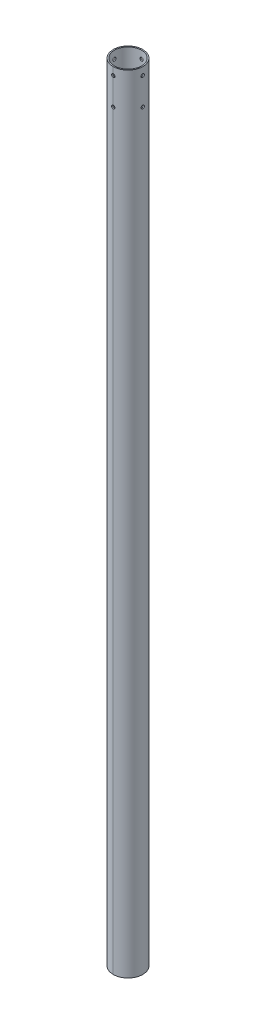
SolidWorks part; units mm, degrees
ref_plane "Plan de face" through (0, 0, 0) normal (0, 0, 1) x (1, 0, 0)
ref_plane "Plan de dessus" through (0, 0, 0) normal (0, 1, 0) x (1, 0, 0)
ref_plane "Plan de droite" through (0, 0, 0) normal (1, 0, 0) x (0, 0, -1)
sketch "Esquisse1" plane through (0, 0, 0) normal (0, 0, 1) x (1, 0, 0)
  line L0 (35, 980) -> (38, 980)
  line L4 (38, 980) -> (38, 3000)
  line L10 (0, 3115.5399) -> (0, -377.5747) construction
  line L11 (35, 980) -> (35, 3000)
  line L12 (38, 3000) -> (35, 3000)
  dimension "D2" = 2020
  dimension "D1" = 3000
  dimension "D4" = 76
  dimension "D9" = 3
revolve "tube" add sketch "Esquisse1" angle 360 about L10
hole_wizard "Trou taraudé M101" positions "Esquisse4" profile "Esquisse3" tap size "M10" standard "Iso"
sketch "Esquisse4" plane through (0, 0, 0) normal (0, 0, 1) x (1, 0, 0)
  line L0 (0, 980) -> (0, 3000) construction
  line L1 (38, 3000) -> (-38, 3000) construction
  point P0 (0, 2980)
  point P4 (0, 2910)
  dimension "D1" = 20
  dimension "D2" = 70
sketch "Esquisse3" plane through (0, 2980, 0) normal (1, 0, 0) x (0, 1, 0)
  line L0 (0, 0) -> (0, 38.001)
  line L1 (0, 38.001) -> (4.25, 38.001)
  line L2 (4.25, 38.001) -> (4.25, 0)
  line L5 (4.25, 0) -> (0, 0)
  line L11 (0, -6.35) -> (0, 107.95) construction
  dimension "Diamètre du trou pour taraudage jusqu'au prochain" = 8.5
  dimension "Profondeur du trou pour taraudage jusqu'au prochain" = 38.001
pattern_circular "Répétition circulaire1" count 4 every 90 about axis through (0, 3115.5399, 0) along (0, 1, 0) of "Trou taraudé M101"
